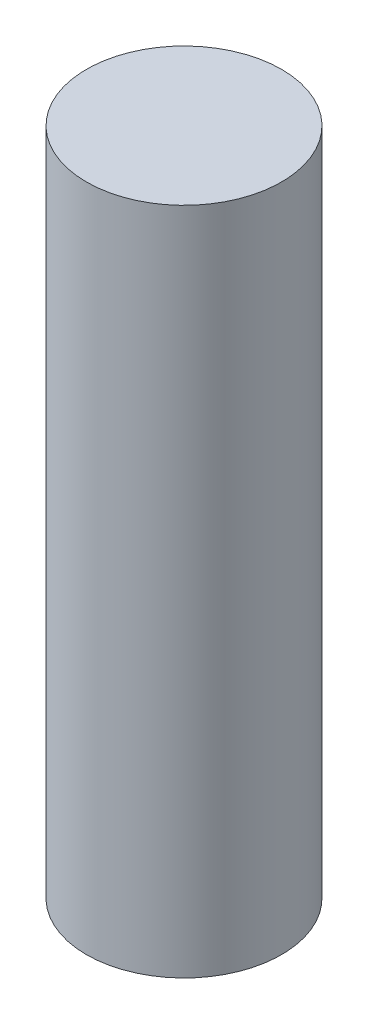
SolidWorks part; units mm, degrees
ref_plane "Front Plane" through (0, 0, 0) normal (0, 0, 1) x (1, 0, 0)
ref_plane "Top Plane" through (0, 0, 0) normal (0, 1, 0) x (1, 0, 0)
ref_plane "Right Plane" through (0, 0, 0) normal (1, 0, 0) x (0, 0, -1)
sketch "Sketch1" plane through (0, 0, 0) normal (0, 1, 0) x (1, 0, 0)
  circle A0 centre (0, 0) radius 44.45
  dimension "D1" = 88.9
extrude "Boss-Extrude1" add sketch "Sketch1" along normal blind 304.8
